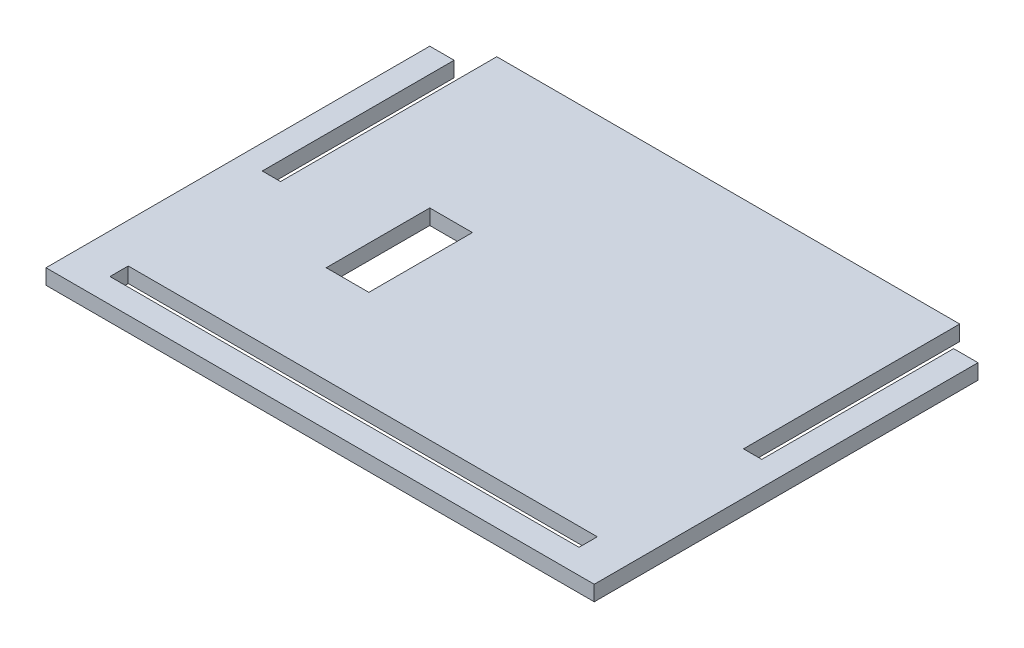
SolidWorks part; units mm, degrees
ref_plane "Front Plane" through (0, 0, 0) normal (0, 0, 1) x (1, 0, 0)
ref_plane "Top Plane" through (0, 0, 0) normal (0, 1, 0) x (1, 0, 0)
ref_plane "Right Plane" through (0, 0, 0) normal (1, 0, 0) x (0, 0, -1)
sketch "Sketch1" plane through (0, 0, 0) normal (0, 1, 0) x (1, 0, 0)
  line L0 (-41, 31.5) -> (-41, 0)
  line L1 (-45, 31.5) -> (-41, 31.5)
  line L2 (-45, 31.5) -> (-45, -31.5)
  line L3 (-45, -31.5) -> (45, -31.5)
  line L4 (45, 31.5) -> (45, -31.5)
  line L5 (-45, 31.5) -> (45, -31.5) construction
  line L6 (-45, -31.5) -> (45, 31.5) construction
  line L7 (-41, 0) -> (-38, 0)
  line L8 (-38, 0) -> (-38, 31.5)
  line L9 (0, -31.5) -> (0, 31.5) construction
  line L10 (38, 0) -> (38, 31.5)
  line L11 (41, 0) -> (38, 0)
  line L12 (41, 31.5) -> (41, 0)
  line L13 (-38, 31.5) -> (38, 31.5)
  line L14 (41, 31.5) -> (45, 31.5)
  line L16 (-38.5, -24.5) -> (38.5, -24.5)
  line L17 (-38.5, -24.5) -> (-38.5, -27.5)
  line L18 (-38.5, -27.5) -> (38.5, -27.5)
  line L19 (38.5, -24.5) -> (38.5, -27.5)
  line L20 (-38.5, -24.5) -> (38.5, -27.5) construction
  line L21 (-38.5, -27.5) -> (38.5, -24.5) construction
  line L45 (-22, 7.5) -> (-15, 7.5)
  line L46 (-22, 7.5) -> (-22, -7.5)
  line L47 (-22, -7.5) -> (-15, -7.5)
  line L48 (-15, 7.5) -> (-15, -7.5)
  line L49 (-22, 7.5) -> (-15, -7.5) construction
  line L50 (-22, -7.5) -> (-15, 7.5) construction
  point P0 (0, 0)
  point P16 (0, -26)
  point P44 (-18.5, 0)
  dimension "D1" = 63
  dimension "D2" = 90
  dimension "D3" = 3
  dimension "D4" = 4
  dimension "D5" = 4
  dimension "D6" = 3
  dimension "D7" = 6.5
  dimension "D8" = 6.5
  dimension "D9" = 23
  dimension "D16" = 7
  dimension "D17" = 15
extrude "Boss-Extrude1" add sketch "Sketch1" along normal blind 2.5
sketch "Sketch2" plane through (0, 2.5, 0) normal (0, 1, 0) x (1, 0, 0)
  line L1 (-38, 31.5) -> (38, 31.5)
  line L2 (-38, 31.5) -> (-38, 35.5)
  line L3 (-38, 35.5) -> (38, 35.5)
  line L4 (38, 31.5) -> (38, 35.5)
  dimension "D1" = 4
extrude "Boss-Extrude2" add sketch "Sketch2" against normal blind 2.5
sketch "Sketch3" plane through (0, 2.5, 0) normal (0, 1, 0) x (1, 0, 0)
  line L0 (-15, 7.5) -> (-22, 7.5) construction
  line L1 (-22, -8.5) -> (-15, -8.5)
  line L2 (-22, -8.5) -> (-22, 8.5)
  line L3 (-22, 8.5) -> (-15, 8.5)
  line L4 (-15, -8.5) -> (-15, 8.5)
  line L5 (-22, -7.5) -> (-15, -7.5) construction
  line L8 (-15, -7.5) -> (-15, 7.5) construction
  line L9 (-22, 7.5) -> (-22, -7.5) construction
  dimension "D1" = 1
  dimension "D2" = 1
extrude "Cut-Extrude1" cut sketch "Sketch3" against normal through all
